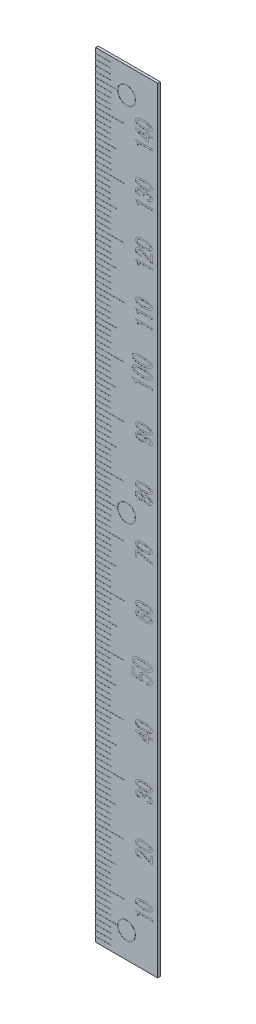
SolidWorks part; units mm, degrees
ref_plane "Front" through (0, 0, 0) normal (0, 0, 1) x (1, 0, 0)
ref_plane "Top" through (0, 0, 0) normal (0, 1, 0) x (1, 0, 0)
ref_plane "Right" through (0, 0, 0) normal (1, 0, 0) x (0, 0, -1)
sketch "Sketch1" plane through (0, 0, 0) normal (0, 0, 1) x (1, 0, 0)
  line L1 (0, 0) -> (0, 150)
  line L2 (0, 0) -> (12, 0)
  line L3 (12, 0) -> (12, 150)
  line L4 (0, 150) -> (12, 150)
  dimension "D1" = 150
  dimension "D2" = 12
extrude "Extrude1" add sketch "Sketch1" along normal blind 0.5
sketch "Sketch2" plane through (0, 0, 0.5) normal (0, 0, 1) x (1, 0, 0)
  line L0 (0, 150) -> (0, 0) construction
  line L1 (0, 0) -> (12, 0) construction
  line L2 (12, 150) -> (0, 150) construction
  circle A0 centre (6, 5) radius 1.75
  circle A1 centre (6, 145) radius 1.75
  circle A2 centre (6, 5) radius 1.65
  circle A3 centre (6, 145) radius 1.65
  circle A4 centre (6, 75) radius 1.75
  circle A5 centre (6, 75) radius 1.65
  dimension "D1" = 6
  dimension "D2" = 6
  dimension "D3" = 5
  dimension "D4" = 5
  dimension "D5" = 3.5
  dimension "D6" = 3.5
  dimension "D7" = 0.1
  dimension "D8" = 2
extrude "Extrude2" cut sketch "Sketch2" against normal blind 0.01
sketch "Sketch3" plane through (0, 0, 0.5) normal (0, 0, 1) x (1, 0, 0)
  line L0 (12, 0) -> (12, 150) construction
  line L1 (7.5, 137.4) -> (11, 137.4) construction
  line L2 (7.5, 137.4) -> (7.5, 140.9) construction
  line L3 (7.5, 140.9) -> (11, 140.9) construction
  line L4 (11, 137.4) -> (11, 140.9) construction
  line L5 (11, 40) -> (-4.9003, 40) construction
  line L6 (11, 127.4) -> (11, 131.525) construction
  line L7 (11, 117.4) -> (11, 121.525) construction
  line L8 (11, 107.4) -> (11, 110.9) construction
  line L9 (11, 97.2) -> (11, 102.8) construction
  line L10 (11, 88.25) -> (11, 92.375) construction
  line L11 (11, 78.25) -> (11, 82.375) construction
  line L12 (11, 68.25) -> (11, 72.375) construction
  line L13 (11, 58.25) -> (11, 62.375) construction
  line L14 (11, 48) -> (11, 52) construction
  line L15 (11, 38.25) -> (11, 42.25) construction
  line L16 (11, 110) -> (-4.9003, 110) construction
  line L17 (11, 50) -> (-4.9003, 50) construction
  line L18 (11, 28.25) -> (11, 32.5) construction
  line L19 (11, 18.25) -> (11, 22.75) construction
  line L20 (11, 8.25) -> (11, 13) construction
  line L21 (11, 100) -> (-4.9003, 100) construction
  line L22 (11, 120) -> (-4.9003, 120) construction
  line L23 (11, 130) -> (-4.9003, 130) construction
  line L24 (11, 140) -> (-4.9003, 140) construction
  line L25 (11, 30) -> (-4.9003, 30) construction
  line L26 (11, 20) -> (-4.9003, 20) construction
  line L27 (11, 10) -> (-4.9003, 10) construction
  line L28 (11, 60) -> (-4.9003, 60) construction
  line L29 (11, 70) -> (-4.9003, 70) construction
  line L30 (11, 80) -> (-4.9003, 80) construction
  line L31 (11, 90) -> (-4.9003, 90) construction
  text T0 "140" font "ＭＳ ゴシック" height in points 11
  text T1 "130" font "ＭＳ ゴシック" height in points 11
  text T2 "120" font "ＭＳ ゴシック" height in points 11
  text T3 "110" font "ＭＳ ゴシック" height in points 11
  text T4 "100" font "ＭＳ ゴシック" height in points 13
  text T5 "90" font "ＭＳ ゴシック" height in points 11
  text T6 "80" font "ＭＳ ゴシック" height in points 11
  text T7 "70" font "ＭＳ ゴシック" height in points 11
  text T8 "60" font "ＭＳ ゴシック" height in points 11
  text T9 "50" font "ＭＳ ゴシック" height in points 13
  text T10 "40" font "ＭＳ ゴシック" height in points 11
  text T11 "30" font "ＭＳ ゴシック" height in points 11
  text T12 "20" font "ＭＳ ゴシック" height in points 11
  text T13 "10" font "ＭＳ ゴシック" height in points 11
  point P6 (11, 139.15)
  point P19 (11, 100)
  dimension "D1" = 3.5
  dimension "D2" = 2.6
  dimension "D3" = 5
  dimension "D4" = 3.5
  dimension "D8" = 2
  dimension "D9" = 50
  dimension "D10" = 2
  dimension "D11" = 5.6
  dimension "D12" = 2.6
  dimension "D5" = 3.5
  dimension "D13" = 2.6
  dimension "D14" = 2.6
  dimension "D15" = 1
  dimension "D16" = 1.75
  dimension "D19" = 1.75
  dimension "D20" = 1.75
  dimension "D21" = 1.75
  dimension "D22" = 1.75
  dimension "D23" = 1.75
  dimension "D24" = 1.75
  dimension "D7" = 1.75
  dimension "D6" = 5
  dimension "D17" = 4
  dimension "D18" = 2
extrude "Extrude3" cut sketch "Sketch3" against normal blind 0.01
sketch "Sketch4" plane through (0, 0, 0.5) normal (0, 0, 1) x (1, 0, 0)
  line L5 (12, 150) -> (0, 150) construction
  line L606 (6, 150) -> (6, 0) construction
  line L607 (0, 0) -> (12, 0) construction
  line L608 (3, 1.05) -> (3, 0.95)
  line L609 (0, 0.95) -> (3, 0.95)
  line L610 (0, 1.05) -> (3, 1.05)
  line L611 (0, 1.05) -> (0, 0.95)
  line L612 (3, 2.05) -> (3, 1.95)
  line L613 (0, 1.95) -> (3, 1.95)
  line L614 (0, 2.05) -> (3, 2.05)
  line L615 (0, 2.05) -> (0, 1.95)
  line L616 (3, 3.05) -> (3, 2.95)
  line L617 (0, 2.95) -> (3, 2.95)
  line L618 (0, 3.05) -> (3, 3.05)
  line L619 (0, 3.05) -> (0, 2.95)
  line L620 (3, 4.05) -> (3, 3.95)
  line L621 (0, 3.95) -> (3, 3.95)
  line L622 (0, 4.05) -> (3, 4.05)
  line L623 (0, 4.05) -> (0, 3.95)
  line L624 (3, 6.05) -> (3, 5.95)
  line L625 (0, 5.95) -> (3, 5.95)
  line L626 (0, 6.05) -> (3, 6.05)
  line L627 (0, 6.05) -> (0, 5.95)
  line L628 (3, 7.05) -> (3, 6.95)
  line L629 (0, 6.95) -> (3, 6.95)
  line L630 (0, 7.05) -> (3, 7.05)
  line L631 (0, 7.05) -> (0, 6.95)
  line L632 (3, 8.05) -> (3, 7.95)
  line L633 (0, 7.95) -> (3, 7.95)
  line L634 (0, 8.05) -> (3, 8.05)
  line L635 (3, 9.05) -> (3, 8.95)
  line L636 (0, 8.95) -> (3, 8.95)
  line L637 (0, 9.05) -> (0, 8.95)
  line L638 (0, 9.05) -> (3, 9.05)
  line L639 (4, 4.95) -> (4, 5.05)
  line L640 (0, 5.05) -> (4, 5.05)
  line L641 (0, 4.95) -> (0, 5.05)
  line L642 (0, 4.95) -> (4, 4.95)
  line L643 (0, 8.05) -> (0, 7.95)
  line L644 (0, 9.95) -> (0, 10.05)
  line L645 (5.5, 9.95) -> (0, 9.95)
  line L646 (5.5, 10.05) -> (5.5, 9.95)
  line L647 (0, 10.05) -> (5.5, 10.05)
  line L648 (3, 11.05) -> (3, 10.95)
  line L649 (0, 10.95) -> (3, 10.95)
  line L650 (0, 11.05) -> (3, 11.05)
  line L651 (0, 11.05) -> (0, 10.95)
  line L652 (3, 12.05) -> (3, 11.95)
  line L653 (0, 11.95) -> (3, 11.95)
  line L654 (0, 12.05) -> (3, 12.05)
  line L655 (0, 12.05) -> (0, 11.95)
  line L656 (3, 13.05) -> (3, 12.95)
  line L657 (0, 12.95) -> (3, 12.95)
  line L658 (0, 13.05) -> (3, 13.05)
  line L659 (0, 13.05) -> (0, 12.95)
  line L660 (3, 14.05) -> (3, 13.95)
  line L661 (0, 13.95) -> (3, 13.95)
  line L662 (0, 14.05) -> (3, 14.05)
  line L663 (0, 14.05) -> (0, 13.95)
  line L664 (3, 16.05) -> (3, 15.95)
  line L665 (0, 15.95) -> (3, 15.95)
  line L666 (0, 16.05) -> (3, 16.05)
  line L667 (0, 16.05) -> (0, 15.95)
  line L668 (3, 17.05) -> (3, 16.95)
  line L669 (0, 16.95) -> (3, 16.95)
  line L670 (0, 17.05) -> (3, 17.05)
  line L671 (0, 17.05) -> (0, 16.95)
  line L672 (3, 18.05) -> (3, 17.95)
  line L673 (0, 17.95) -> (3, 17.95)
  line L674 (0, 18.05) -> (3, 18.05)
  line L675 (3, 19.05) -> (3, 18.95)
  line L676 (0, 18.95) -> (3, 18.95)
  line L677 (0, 19.05) -> (0, 18.95)
  line L678 (0, 19.05) -> (3, 19.05)
  line L679 (4, 14.95) -> (4, 15.05)
  line L680 (0, 15.05) -> (4, 15.05)
  line L681 (0, 14.95) -> (0, 15.05)
  line L682 (0, 14.95) -> (4, 14.95)
  line L683 (0, 18.05) -> (0, 17.95)
  line L684 (0, 19.95) -> (0, 20.05)
  line L685 (5.5, 19.95) -> (0, 19.95)
  line L686 (5.5, 20.05) -> (5.5, 19.95)
  line L687 (0, 20.05) -> (5.5, 20.05)
  line L688 (3, 21.05) -> (3, 20.95)
  line L689 (0, 20.95) -> (3, 20.95)
  line L690 (0, 21.05) -> (3, 21.05)
  line L691 (0, 21.05) -> (0, 20.95)
  line L692 (3, 22.05) -> (3, 21.95)
  line L693 (0, 21.95) -> (3, 21.95)
  line L694 (0, 22.05) -> (3, 22.05)
  line L695 (0, 22.05) -> (0, 21.95)
  line L696 (3, 23.05) -> (3, 22.95)
  line L697 (0, 22.95) -> (3, 22.95)
  line L698 (0, 23.05) -> (3, 23.05)
  line L699 (0, 23.05) -> (0, 22.95)
  line L700 (3, 24.05) -> (3, 23.95)
  line L701 (0, 23.95) -> (3, 23.95)
  line L702 (0, 24.05) -> (3, 24.05)
  line L703 (0, 24.05) -> (0, 23.95)
  line L704 (3, 26.05) -> (3, 25.95)
  line L705 (0, 25.95) -> (3, 25.95)
  line L706 (0, 26.05) -> (3, 26.05)
  line L707 (0, 26.05) -> (0, 25.95)
  line L708 (3, 27.05) -> (3, 26.95)
  line L709 (0, 26.95) -> (3, 26.95)
  line L710 (0, 27.05) -> (3, 27.05)
  line L711 (0, 27.05) -> (0, 26.95)
  line L712 (3, 28.05) -> (3, 27.95)
  line L713 (0, 27.95) -> (3, 27.95)
  line L714 (0, 28.05) -> (3, 28.05)
  line L715 (3, 29.05) -> (3, 28.95)
  line L716 (0, 28.95) -> (3, 28.95)
  line L717 (0, 29.05) -> (0, 28.95)
  line L718 (0, 29.05) -> (3, 29.05)
  line L719 (4, 24.95) -> (4, 25.05)
  line L720 (0, 25.05) -> (4, 25.05)
  line L721 (0, 24.95) -> (0, 25.05)
  line L722 (0, 24.95) -> (4, 24.95)
  line L723 (0, 28.05) -> (0, 27.95)
  line L724 (0, 29.95) -> (0, 30.05)
  line L725 (5.5, 29.95) -> (0, 29.95)
  line L726 (5.5, 30.05) -> (5.5, 29.95)
  line L727 (0, 30.05) -> (5.5, 30.05)
  line L728 (3, 31.05) -> (3, 30.95)
  line L729 (0, 30.95) -> (3, 30.95)
  line L730 (0, 31.05) -> (3, 31.05)
  line L731 (0, 31.05) -> (0, 30.95)
  line L732 (3, 32.05) -> (3, 31.95)
  line L733 (0, 31.95) -> (3, 31.95)
  line L734 (0, 32.05) -> (3, 32.05)
  line L735 (0, 32.05) -> (0, 31.95)
  line L736 (3, 33.05) -> (3, 32.95)
  line L737 (0, 32.95) -> (3, 32.95)
  line L738 (0, 33.05) -> (3, 33.05)
  line L739 (0, 33.05) -> (0, 32.95)
  line L740 (3, 34.05) -> (3, 33.95)
  line L741 (0, 33.95) -> (3, 33.95)
  line L742 (0, 34.05) -> (3, 34.05)
  line L743 (0, 34.05) -> (0, 33.95)
  line L744 (3, 36.05) -> (3, 35.95)
  line L745 (0, 35.95) -> (3, 35.95)
  line L746 (0, 36.05) -> (3, 36.05)
  line L747 (0, 36.05) -> (0, 35.95)
  line L748 (3, 37.05) -> (3, 36.95)
  line L749 (0, 36.95) -> (3, 36.95)
  line L750 (0, 37.05) -> (3, 37.05)
  line L751 (0, 37.05) -> (0, 36.95)
  line L752 (3, 38.05) -> (3, 37.95)
  line L753 (0, 37.95) -> (3, 37.95)
  line L754 (0, 38.05) -> (3, 38.05)
  line L755 (3, 39.05) -> (3, 38.95)
  line L756 (0, 38.95) -> (3, 38.95)
  line L757 (0, 39.05) -> (0, 38.95)
  line L758 (0, 39.05) -> (3, 39.05)
  line L759 (4, 34.95) -> (4, 35.05)
  line L760 (0, 35.05) -> (4, 35.05)
  line L761 (0, 34.95) -> (0, 35.05)
  line L762 (0, 34.95) -> (4, 34.95)
  line L763 (0, 38.05) -> (0, 37.95)
  line L764 (0, 39.95) -> (0, 40.05)
  line L765 (5.5, 39.95) -> (0, 39.95)
  line L766 (5.5, 40.05) -> (5.5, 39.95)
  line L767 (0, 40.05) -> (5.5, 40.05)
  line L768 (3, 41.05) -> (3, 40.95)
  line L769 (0, 40.95) -> (3, 40.95)
  line L770 (0, 41.05) -> (3, 41.05)
  line L771 (0, 41.05) -> (0, 40.95)
  line L772 (3, 42.05) -> (3, 41.95)
  line L773 (0, 41.95) -> (3, 41.95)
  line L774 (0, 42.05) -> (3, 42.05)
  line L775 (0, 42.05) -> (0, 41.95)
  line L776 (3, 43.05) -> (3, 42.95)
  line L777 (0, 42.95) -> (3, 42.95)
  line L778 (0, 43.05) -> (3, 43.05)
  line L779 (0, 43.05) -> (0, 42.95)
  line L780 (3, 44.05) -> (3, 43.95)
  line L781 (0, 43.95) -> (3, 43.95)
  line L782 (0, 44.05) -> (3, 44.05)
  line L783 (0, 44.05) -> (0, 43.95)
  line L784 (3, 46.05) -> (3, 45.95)
  line L785 (0, 45.95) -> (3, 45.95)
  line L786 (0, 46.05) -> (3, 46.05)
  line L787 (0, 46.05) -> (0, 45.95)
  line L788 (3, 47.05) -> (3, 46.95)
  line L789 (0, 46.95) -> (3, 46.95)
  line L790 (0, 47.05) -> (3, 47.05)
  line L791 (0, 47.05) -> (0, 46.95)
  line L792 (3, 48.05) -> (3, 47.95)
  line L793 (0, 47.95) -> (3, 47.95)
  line L794 (0, 48.05) -> (3, 48.05)
  line L795 (3, 49.05) -> (3, 48.95)
  line L796 (0, 48.95) -> (3, 48.95)
  line L797 (0, 49.05) -> (0, 48.95)
  line L798 (0, 49.05) -> (3, 49.05)
  line L799 (4, 44.95) -> (4, 45.05)
  line L800 (0, 45.05) -> (4, 45.05)
  line L801 (0, 44.95) -> (0, 45.05)
  line L802 (0, 44.95) -> (4, 44.95)
  line L803 (0, 48.05) -> (0, 47.95)
  line L804 (0, 49.95) -> (0, 50.05)
  line L805 (5.5, 49.95) -> (0, 49.95)
  line L806 (5.5, 50.05) -> (5.5, 49.95)
  line L807 (0, 50.05) -> (5.5, 50.05)
  line L808 (3, 51.05) -> (3, 50.95)
  line L809 (0, 50.95) -> (3, 50.95)
  line L810 (0, 51.05) -> (3, 51.05)
  line L811 (0, 51.05) -> (0, 50.95)
  line L812 (3, 52.05) -> (3, 51.95)
  line L813 (0, 51.95) -> (3, 51.95)
  line L814 (0, 52.05) -> (3, 52.05)
  line L815 (0, 52.05) -> (0, 51.95)
  line L816 (3, 53.05) -> (3, 52.95)
  line L817 (0, 52.95) -> (3, 52.95)
  line L818 (0, 53.05) -> (3, 53.05)
  line L819 (0, 53.05) -> (0, 52.95)
  line L820 (3, 54.05) -> (3, 53.95)
  line L821 (0, 53.95) -> (3, 53.95)
  line L822 (0, 54.05) -> (3, 54.05)
  line L823 (0, 54.05) -> (0, 53.95)
  line L824 (3, 56.05) -> (3, 55.95)
  line L825 (0, 55.95) -> (3, 55.95)
  line L826 (0, 56.05) -> (3, 56.05)
  line L827 (0, 56.05) -> (0, 55.95)
  line L828 (3, 57.05) -> (3, 56.95)
  line L829 (0, 56.95) -> (3, 56.95)
  line L830 (0, 57.05) -> (3, 57.05)
  line L831 (0, 57.05) -> (0, 56.95)
  line L832 (3, 58.05) -> (3, 57.95)
  line L833 (0, 57.95) -> (3, 57.95)
  line L834 (0, 58.05) -> (3, 58.05)
  line L835 (3, 59.05) -> (3, 58.95)
  line L836 (0, 58.95) -> (3, 58.95)
  line L837 (0, 59.05) -> (0, 58.95)
  line L838 (0, 59.05) -> (3, 59.05)
  line L839 (4, 54.95) -> (4, 55.05)
  line L840 (0, 55.05) -> (4, 55.05)
  line L841 (0, 54.95) -> (0, 55.05)
  line L842 (0, 54.95) -> (4, 54.95)
  line L843 (0, 58.05) -> (0, 57.95)
  line L844 (0, 59.95) -> (0, 60.05)
  line L845 (5.5, 59.95) -> (0, 59.95)
  line L846 (5.5, 60.05) -> (5.5, 59.95)
  line L847 (0, 60.05) -> (5.5, 60.05)
  line L848 (3, 61.05) -> (3, 60.95)
  line L849 (0, 60.95) -> (3, 60.95)
  line L850 (0, 61.05) -> (3, 61.05)
  line L851 (0, 61.05) -> (0, 60.95)
  line L852 (3, 62.05) -> (3, 61.95)
  line L853 (0, 61.95) -> (3, 61.95)
  line L854 (0, 62.05) -> (3, 62.05)
  line L855 (0, 62.05) -> (0, 61.95)
  line L856 (3, 63.05) -> (3, 62.95)
  line L857 (0, 62.95) -> (3, 62.95)
  line L858 (0, 63.05) -> (3, 63.05)
  line L859 (0, 63.05) -> (0, 62.95)
  line L860 (3, 64.05) -> (3, 63.95)
  line L861 (0, 63.95) -> (3, 63.95)
  line L862 (0, 64.05) -> (3, 64.05)
  line L863 (0, 64.05) -> (0, 63.95)
  line L864 (3, 66.05) -> (3, 65.95)
  line L865 (0, 65.95) -> (3, 65.95)
  line L866 (0, 66.05) -> (3, 66.05)
  line L867 (0, 66.05) -> (0, 65.95)
  line L868 (3, 67.05) -> (3, 66.95)
  line L869 (0, 66.95) -> (3, 66.95)
  line L870 (0, 67.05) -> (3, 67.05)
  line L871 (0, 67.05) -> (0, 66.95)
  line L872 (3, 68.05) -> (3, 67.95)
  line L873 (0, 67.95) -> (3, 67.95)
  line L874 (0, 68.05) -> (3, 68.05)
  line L875 (3, 69.05) -> (3, 68.95)
  line L876 (0, 68.95) -> (3, 68.95)
  line L877 (0, 69.05) -> (0, 68.95)
  line L878 (0, 69.05) -> (3, 69.05)
  line L879 (4, 64.95) -> (4, 65.05)
  line L880 (0, 65.05) -> (4, 65.05)
  line L881 (0, 64.95) -> (0, 65.05)
  line L882 (0, 64.95) -> (4, 64.95)
  line L883 (0, 68.05) -> (0, 67.95)
  line L884 (0, 69.95) -> (0, 70.05)
  line L885 (5.5, 69.95) -> (0, 69.95)
  line L886 (5.5, 70.05) -> (5.5, 69.95)
  line L887 (0, 70.05) -> (5.5, 70.05)
  line L888 (3, 71.05) -> (3, 70.95)
  line L889 (0, 70.95) -> (3, 70.95)
  line L890 (0, 71.05) -> (3, 71.05)
  line L891 (0, 71.05) -> (0, 70.95)
  line L892 (3, 72.05) -> (3, 71.95)
  line L893 (0, 71.95) -> (3, 71.95)
  line L894 (0, 72.05) -> (3, 72.05)
  line L895 (0, 72.05) -> (0, 71.95)
  line L896 (3, 73.05) -> (3, 72.95)
  line L897 (0, 72.95) -> (3, 72.95)
  line L898 (0, 73.05) -> (3, 73.05)
  line L899 (0, 73.05) -> (0, 72.95)
  line L900 (3, 74.05) -> (3, 73.95)
  line L901 (0, 73.95) -> (3, 73.95)
  line L902 (0, 74.05) -> (3, 74.05)
  line L903 (0, 74.05) -> (0, 73.95)
  line L904 (3, 76.05) -> (3, 75.95)
  line L905 (0, 75.95) -> (3, 75.95)
  line L906 (0, 76.05) -> (3, 76.05)
  line L907 (0, 76.05) -> (0, 75.95)
  line L908 (3, 77.05) -> (3, 76.95)
  line L909 (0, 76.95) -> (3, 76.95)
  line L910 (0, 77.05) -> (3, 77.05)
  line L911 (0, 77.05) -> (0, 76.95)
  line L912 (3, 78.05) -> (3, 77.95)
  line L913 (0, 77.95) -> (3, 77.95)
  line L914 (0, 78.05) -> (3, 78.05)
  line L915 (3, 79.05) -> (3, 78.95)
  line L916 (0, 78.95) -> (3, 78.95)
  line L917 (0, 79.05) -> (0, 78.95)
  line L918 (0, 79.05) -> (3, 79.05)
  line L919 (4, 74.95) -> (4, 75.05)
  line L920 (0, 75.05) -> (4, 75.05)
  line L921 (0, 74.95) -> (0, 75.05)
  line L922 (0, 74.95) -> (4, 74.95)
  line L923 (0, 78.05) -> (0, 77.95)
  line L924 (0, 79.95) -> (0, 80.05)
  line L925 (5.5, 79.95) -> (0, 79.95)
  line L926 (5.5, 80.05) -> (5.5, 79.95)
  line L927 (0, 80.05) -> (5.5, 80.05)
  line L928 (3, 81.05) -> (3, 80.95)
  line L929 (0, 80.95) -> (3, 80.95)
  line L930 (0, 81.05) -> (3, 81.05)
  line L931 (0, 81.05) -> (0, 80.95)
  line L932 (3, 82.05) -> (3, 81.95)
  line L933 (0, 81.95) -> (3, 81.95)
  line L934 (0, 82.05) -> (3, 82.05)
  line L935 (0, 82.05) -> (0, 81.95)
  line L936 (3, 83.05) -> (3, 82.95)
  line L937 (0, 82.95) -> (3, 82.95)
  line L938 (0, 83.05) -> (3, 83.05)
  line L939 (0, 83.05) -> (0, 82.95)
  line L940 (3, 84.05) -> (3, 83.95)
  line L941 (0, 83.95) -> (3, 83.95)
  line L942 (0, 84.05) -> (3, 84.05)
  line L943 (0, 84.05) -> (0, 83.95)
  line L944 (3, 86.05) -> (3, 85.95)
  line L945 (0, 85.95) -> (3, 85.95)
  line L946 (0, 86.05) -> (3, 86.05)
  line L947 (0, 86.05) -> (0, 85.95)
  line L948 (3, 87.05) -> (3, 86.95)
  line L949 (0, 86.95) -> (3, 86.95)
  line L950 (0, 87.05) -> (3, 87.05)
  line L951 (0, 87.05) -> (0, 86.95)
  line L952 (3, 88.05) -> (3, 87.95)
  line L953 (0, 87.95) -> (3, 87.95)
  line L954 (0, 88.05) -> (3, 88.05)
  line L955 (3, 89.05) -> (3, 88.95)
  line L956 (0, 88.95) -> (3, 88.95)
  line L957 (0, 89.05) -> (0, 88.95)
  line L958 (0, 89.05) -> (3, 89.05)
  line L959 (4, 84.95) -> (4, 85.05)
  line L960 (0, 85.05) -> (4, 85.05)
  line L961 (0, 84.95) -> (0, 85.05)
  line L962 (0, 84.95) -> (4, 84.95)
  line L963 (0, 88.05) -> (0, 87.95)
  line L964 (0, 89.95) -> (0, 90.05)
  line L965 (5.5, 89.95) -> (0, 89.95)
  line L966 (5.5, 90.05) -> (5.5, 89.95)
  line L967 (0, 90.05) -> (5.5, 90.05)
  line L968 (3, 91.05) -> (3, 90.95)
  line L969 (0, 90.95) -> (3, 90.95)
  line L970 (0, 91.05) -> (3, 91.05)
  line L971 (0, 91.05) -> (0, 90.95)
  line L972 (3, 92.05) -> (3, 91.95)
  line L973 (0, 91.95) -> (3, 91.95)
  line L974 (0, 92.05) -> (3, 92.05)
  line L975 (0, 92.05) -> (0, 91.95)
  line L976 (3, 93.05) -> (3, 92.95)
  line L977 (0, 92.95) -> (3, 92.95)
  line L978 (0, 93.05) -> (3, 93.05)
  line L979 (0, 93.05) -> (0, 92.95)
  line L980 (3, 94.05) -> (3, 93.95)
  line L981 (0, 93.95) -> (3, 93.95)
  line L982 (0, 94.05) -> (3, 94.05)
  line L983 (0, 94.05) -> (0, 93.95)
  line L984 (3, 96.05) -> (3, 95.95)
  line L985 (0, 95.95) -> (3, 95.95)
  line L986 (0, 96.05) -> (3, 96.05)
  line L987 (0, 96.05) -> (0, 95.95)
  line L988 (3, 97.05) -> (3, 96.95)
  line L989 (0, 96.95) -> (3, 96.95)
  line L990 (0, 97.05) -> (3, 97.05)
  line L991 (0, 97.05) -> (0, 96.95)
  line L992 (3, 98.05) -> (3, 97.95)
  line L993 (0, 97.95) -> (3, 97.95)
  line L994 (0, 98.05) -> (3, 98.05)
  line L995 (3, 99.05) -> (3, 98.95)
  line L996 (0, 98.95) -> (3, 98.95)
  line L997 (0, 99.05) -> (0, 98.95)
  line L998 (0, 99.05) -> (3, 99.05)
  line L999 (4, 94.95) -> (4, 95.05)
  line L1000 (0, 95.05) -> (4, 95.05)
  line L1001 (0, 94.95) -> (0, 95.05)
  line L1002 (0, 94.95) -> (4, 94.95)
  line L1003 (0, 98.05) -> (0, 97.95)
  line L1004 (3, 101.05) -> (3, 100.95)
  line L1005 (0, 100.95) -> (3, 100.95)
  line L1006 (0, 101.05) -> (3, 101.05)
  line L1007 (0, 101.05) -> (0, 100.95)
  line L1008 (3, 102.05) -> (3, 101.95)
  line L1009 (0, 101.95) -> (3, 101.95)
  line L1010 (0, 102.05) -> (3, 102.05)
  line L1011 (0, 102.05) -> (0, 101.95)
  line L1012 (3, 103.05) -> (3, 102.95)
  line L1013 (0, 102.95) -> (3, 102.95)
  line L1014 (0, 103.05) -> (3, 103.05)
  line L1015 (0, 103.05) -> (0, 102.95)
  line L1016 (3, 104.05) -> (3, 103.95)
  line L1017 (0, 103.95) -> (3, 103.95)
  line L1018 (0, 104.05) -> (3, 104.05)
  line L1019 (0, 104.05) -> (0, 103.95)
  line L1020 (3, 106.05) -> (3, 105.95)
  line L1021 (0, 105.95) -> (3, 105.95)
  line L1022 (0, 106.05) -> (3, 106.05)
  line L1023 (0, 106.05) -> (0, 105.95)
  line L1024 (3, 107.05) -> (3, 106.95)
  line L1025 (0, 106.95) -> (3, 106.95)
  line L1026 (0, 107.05) -> (3, 107.05)
  line L1027 (0, 107.05) -> (0, 106.95)
  line L1028 (3, 108.05) -> (3, 107.95)
  line L1029 (0, 107.95) -> (3, 107.95)
  line L1030 (0, 108.05) -> (3, 108.05)
  line L1031 (3, 109.05) -> (3, 108.95)
  line L1032 (0, 108.95) -> (3, 108.95)
  line L1033 (0, 109.05) -> (0, 108.95)
  line L1034 (0, 109.05) -> (3, 109.05)
  line L1035 (4, 104.95) -> (4, 105.05)
  line L1036 (0, 105.05) -> (4, 105.05)
  line L1037 (0, 104.95) -> (0, 105.05)
  line L1038 (0, 104.95) -> (4, 104.95)
  line L1039 (0, 108.05) -> (0, 107.95)
  line L1040 (0, 99.95) -> (0, 100.05)
  line L1041 (5.5, 99.95) -> (0, 99.95)
  line L1042 (5.5, 100.05) -> (5.5, 99.95)
  line L1043 (0, 100.05) -> (5.5, 100.05)
  line L1044 (3, 111.05) -> (3, 110.95)
  line L1045 (0, 110.95) -> (3, 110.95)
  line L1046 (0, 111.05) -> (3, 111.05)
  line L1047 (0, 111.05) -> (0, 110.95)
  line L1048 (3, 112.05) -> (3, 111.95)
  line L1049 (0, 111.95) -> (3, 111.95)
  line L1050 (0, 112.05) -> (3, 112.05)
  line L1051 (0, 112.05) -> (0, 111.95)
  line L1052 (3, 113.05) -> (3, 112.95)
  line L1053 (0, 112.95) -> (3, 112.95)
  line L1054 (0, 113.05) -> (3, 113.05)
  line L1055 (0, 113.05) -> (0, 112.95)
  line L1056 (3, 114.05) -> (3, 113.95)
  line L1057 (0, 113.95) -> (3, 113.95)
  line L1058 (0, 114.05) -> (3, 114.05)
  line L1059 (0, 114.05) -> (0, 113.95)
  line L1060 (3, 116.05) -> (3, 115.95)
  line L1061 (0, 115.95) -> (3, 115.95)
  line L1062 (0, 116.05) -> (3, 116.05)
  line L1063 (0, 116.05) -> (0, 115.95)
  line L1064 (3, 117.05) -> (3, 116.95)
  line L1065 (0, 116.95) -> (3, 116.95)
  line L1066 (0, 117.05) -> (3, 117.05)
  line L1067 (0, 117.05) -> (0, 116.95)
  line L1068 (3, 118.05) -> (3, 117.95)
  line L1069 (0, 117.95) -> (3, 117.95)
  line L1070 (0, 118.05) -> (3, 118.05)
  line L1071 (3, 119.05) -> (3, 118.95)
  line L1072 (0, 118.95) -> (3, 118.95)
  line L1073 (0, 119.05) -> (0, 118.95)
  line L1074 (0, 119.05) -> (3, 119.05)
  line L1075 (4, 114.95) -> (4, 115.05)
  line L1076 (0, 115.05) -> (4, 115.05)
  line L1077 (0, 114.95) -> (0, 115.05)
  line L1078 (0, 114.95) -> (4, 114.95)
  line L1079 (0, 118.05) -> (0, 117.95)
  line L1080 (0, 109.95) -> (0, 110.05)
  line L1081 (5.5, 109.95) -> (0, 109.95)
  line L1082 (5.5, 110.05) -> (5.5, 109.95)
  line L1083 (0, 110.05) -> (5.5, 110.05)
  line L1084 (3, 121.05) -> (3, 120.95)
  line L1085 (0, 120.95) -> (3, 120.95)
  line L1086 (0, 121.05) -> (3, 121.05)
  line L1087 (0, 121.05) -> (0, 120.95)
  line L1088 (3, 122.05) -> (3, 121.95)
  line L1089 (0, 121.95) -> (3, 121.95)
  line L1090 (0, 122.05) -> (3, 122.05)
  line L1091 (0, 122.05) -> (0, 121.95)
  line L1092 (3, 123.05) -> (3, 122.95)
  line L1093 (0, 122.95) -> (3, 122.95)
  line L1094 (0, 123.05) -> (3, 123.05)
  line L1095 (0, 123.05) -> (0, 122.95)
  line L1096 (3, 124.05) -> (3, 123.95)
  line L1097 (0, 123.95) -> (3, 123.95)
  line L1098 (0, 124.05) -> (3, 124.05)
  line L1099 (0, 124.05) -> (0, 123.95)
  line L1100 (3, 126.05) -> (3, 125.95)
  line L1101 (0, 125.95) -> (3, 125.95)
  line L1102 (0, 126.05) -> (3, 126.05)
  line L1103 (0, 126.05) -> (0, 125.95)
  line L1104 (3, 127.05) -> (3, 126.95)
  line L1105 (0, 126.95) -> (3, 126.95)
  line L1106 (0, 127.05) -> (3, 127.05)
  line L1107 (0, 127.05) -> (0, 126.95)
  line L1108 (3, 128.05) -> (3, 127.95)
  line L1109 (0, 127.95) -> (3, 127.95)
  line L1110 (0, 128.05) -> (3, 128.05)
  line L1111 (3, 129.05) -> (3, 128.95)
  line L1112 (0, 128.95) -> (3, 128.95)
  line L1113 (0, 129.05) -> (0, 128.95)
  line L1114 (0, 129.05) -> (3, 129.05)
  line L1115 (4, 124.95) -> (4, 125.05)
  line L1116 (0, 125.05) -> (4, 125.05)
  line L1117 (0, 124.95) -> (0, 125.05)
  line L1118 (0, 124.95) -> (4, 124.95)
  line L1119 (0, 128.05) -> (0, 127.95)
  line L1120 (0, 119.95) -> (0, 120.05)
  line L1121 (5.5, 119.95) -> (0, 119.95)
  line L1122 (5.5, 120.05) -> (5.5, 119.95)
  line L1123 (0, 120.05) -> (5.5, 120.05)
  line L1124 (3, 131.05) -> (3, 130.95)
  line L1125 (0, 130.95) -> (3, 130.95)
  line L1126 (0, 131.05) -> (3, 131.05)
  line L1127 (0, 131.05) -> (0, 130.95)
  line L1128 (3, 132.05) -> (3, 131.95)
  line L1129 (0, 131.95) -> (3, 131.95)
  line L1130 (0, 132.05) -> (3, 132.05)
  line L1131 (0, 132.05) -> (0, 131.95)
  line L1132 (3, 133.05) -> (3, 132.95)
  line L1133 (0, 132.95) -> (3, 132.95)
  line L1134 (0, 133.05) -> (3, 133.05)
  line L1135 (0, 133.05) -> (0, 132.95)
  line L1136 (3, 134.05) -> (3, 133.95)
  line L1137 (0, 133.95) -> (3, 133.95)
  line L1138 (0, 134.05) -> (3, 134.05)
  line L1139 (0, 134.05) -> (0, 133.95)
  line L1140 (3, 136.05) -> (3, 135.95)
  line L1141 (0, 135.95) -> (3, 135.95)
  line L1142 (0, 136.05) -> (3, 136.05)
  line L1143 (0, 136.05) -> (0, 135.95)
  line L1144 (3, 137.05) -> (3, 136.95)
  line L1145 (0, 136.95) -> (3, 136.95)
  line L1146 (0, 137.05) -> (3, 137.05)
  line L1147 (0, 137.05) -> (0, 136.95)
  line L1148 (3, 138.05) -> (3, 137.95)
  line L1149 (0, 137.95) -> (3, 137.95)
  line L1150 (0, 138.05) -> (3, 138.05)
  line L1151 (3, 139.05) -> (3, 138.95)
  line L1152 (0, 138.95) -> (3, 138.95)
  line L1153 (0, 139.05) -> (0, 138.95)
  line L1154 (0, 139.05) -> (3, 139.05)
  line L1155 (4, 134.95) -> (4, 135.05)
  line L1156 (0, 135.05) -> (4, 135.05)
  line L1157 (0, 134.95) -> (0, 135.05)
  line L1158 (0, 134.95) -> (4, 134.95)
  line L1159 (0, 138.05) -> (0, 137.95)
  line L1160 (3, 141.05) -> (3, 140.95)
  line L1161 (0, 140.95) -> (3, 140.95)
  line L1162 (0, 141.05) -> (3, 141.05)
  line L1163 (0, 141.05) -> (0, 140.95)
  line L1164 (3, 142.05) -> (3, 141.95)
  line L1165 (0, 141.95) -> (3, 141.95)
  line L1166 (0, 142.05) -> (3, 142.05)
  line L1167 (0, 142.05) -> (0, 141.95)
  line L1168 (3, 143.05) -> (3, 142.95)
  line L1169 (0, 142.95) -> (3, 142.95)
  line L1170 (0, 143.05) -> (3, 143.05)
  line L1171 (0, 143.05) -> (0, 142.95)
  line L1172 (3, 144.05) -> (3, 143.95)
  line L1173 (0, 143.95) -> (3, 143.95)
  line L1174 (0, 144.05) -> (3, 144.05)
  line L1175 (0, 144.05) -> (0, 143.95)
  line L1176 (0, 129.95) -> (0, 130.05)
  line L1177 (5.5, 129.95) -> (0, 129.95)
  line L1178 (5.5, 130.05) -> (5.5, 129.95)
  line L1179 (0, 130.05) -> (5.5, 130.05)
  line L1180 (3, 146.05) -> (3, 145.95)
  line L1181 (0, 145.95) -> (3, 145.95)
  line L1182 (0, 146.05) -> (3, 146.05)
  line L1183 (0, 146.05) -> (0, 145.95)
  line L1184 (3, 147.05) -> (3, 146.95)
  line L1185 (0, 146.95) -> (3, 146.95)
  line L1186 (0, 147.05) -> (3, 147.05)
  line L1187 (0, 147.05) -> (0, 146.95)
  line L1188 (3, 148.05) -> (3, 147.95)
  line L1189 (0, 147.95) -> (3, 147.95)
  line L1190 (0, 148.05) -> (3, 148.05)
  line L1191 (3, 149.05) -> (3, 148.95)
  line L1192 (0, 148.95) -> (3, 148.95)
  line L1193 (0, 149.05) -> (0, 148.95)
  line L1194 (0, 149.05) -> (3, 149.05)
  line L1195 (4, 144.95) -> (4, 145.05)
  line L1196 (0, 145.05) -> (4, 145.05)
  line L1197 (0, 144.95) -> (0, 145.05)
  line L1198 (0, 144.95) -> (4, 144.95)
  line L1199 (0, 148.05) -> (0, 147.95)
  line L1200 (0, 139.95) -> (0, 140.05)
  line L1201 (5.5, 139.95) -> (0, 139.95)
  line L1202 (5.5, 140.05) -> (5.5, 139.95)
  line L1203 (0, 140.05) -> (5.5, 140.05)
extrude "Extrude4" cut sketch "Sketch4" against normal blind 0.01
move or copy body "Body-Move/Copy2" bodies to move or copy 105 copy no translate (-12, 0, 0)
